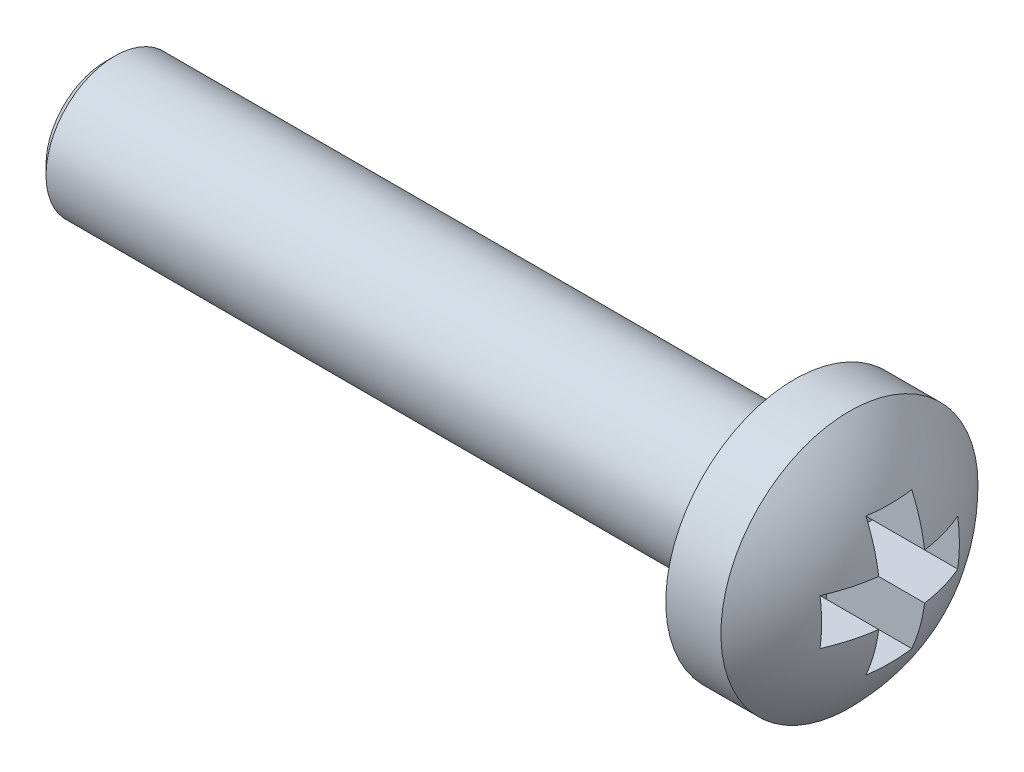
SolidWorks part; units mm, degrees
ref_plane "Plan de face" through (0, 0, 0) normal (0, 0, 1) x (1, 0, 0)
ref_plane "Plan de dessus" through (0, 0, 0) normal (0, 1, 0) x (1, 0, 0)
ref_plane "Plan de droite" through (0, 0, 0) normal (1, 0, 0) x (0, 0, -1)
sketch "Esquisse1" plane through (0, 0, 0) normal (0, 0, 1) x (1, 0, 0)
  line L0 (11.0618, 0) -> (-32.4908, 0) construction
  line L1 (0, 1.5) -> (0, 2.8)
  line L2 (0, 2.8) -> (1.2, 2.8)
  line L3 (0, 1.5) -> (-15, 1.5)
  line L4 (-15, 1.5) -> (-15, 0)
  line L5 (2.4, -1.2574) -> (2.4, 1.2574) construction
  line L6 (2.4, 0) -> (-15, 0)
  spline S0 degree 2 poles (1.2, 2.8) (2.4, 1.5717) (2.4, 0) knots 0 0 0 1 1 1
  dimension "D1" = 1.5
  dimension "D2" = 15
  dimension "D3" = 2.8
  dimension "D4" = 1.2
  dimension "D5" = 2.4
revolve "Révolution1" add sketch "Esquisse1" angle 360 about L0
chamfer "Chanfrein1" distance 0.2 angle 45 1 edges at (-15, 0, -1.5)
sketch "Esquisse2" plane through (0, 0, 0) normal (-1, 0, 0) x (0, 0, 1)
  line L0 (-0.5, 0.5) -> (-1.5, 0.5)
  line L1 (0.5, 1.5) -> (-0.5, 1.5)
  line L2 (0.5, 1.5) -> (0.5, 0.5)
  line L3 (0.5, -1.5) -> (-0.5, -1.5)
  line L4 (-0.5, 1.5) -> (-0.5, 0.5)
  line L5 (1.5, 0.5) -> (0.5, 0.5)
  line L6 (1.5, 0.5) -> (1.5, -0.5)
  line L7 (1.5, -0.5) -> (0.5, -0.5)
  line L8 (-1.5, 0.5) -> (-1.5, -0.5)
  line L9 (0.5, -0.5) -> (0.5, -1.5)
  line L10 (-0.5, -0.5) -> (-1.5, -0.5)
  line L11 (-0.5, -0.5) -> (-0.5, -1.5)
  dimension "D1" = 1
  dimension "D2" = 3
  dimension "D3" = 1.5
  dimension "D4" = 1.5
extrude "Enlèv. mat.-Extru.1" cut sketch "Esquisse2" along normal blind 2.2 from offset 2.4
